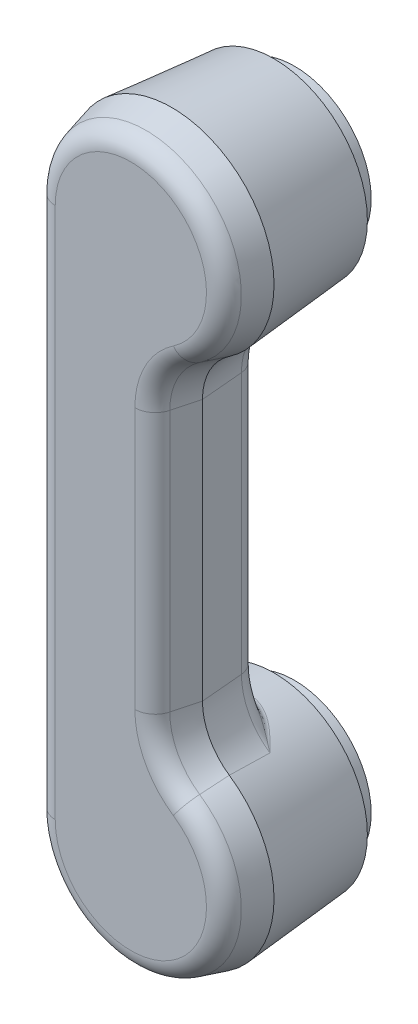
SolidWorks part; units mm, degrees
other "<robot_arm_right>-<Extrude2>"
ref_plane "Front Plane" through (0, 0, 0) normal (0, 0, 1) x (1, 0, 0)
ref_plane "Top Plane" through (0, 0, 0) normal (0, 1, 0) x (1, 0, 0)
ref_plane "Right Plane" through (0, 0, 0) normal (1, 0, 0) x (0, 0, -1)
mirrored part "robot_arm_right_&_Mirrored"
